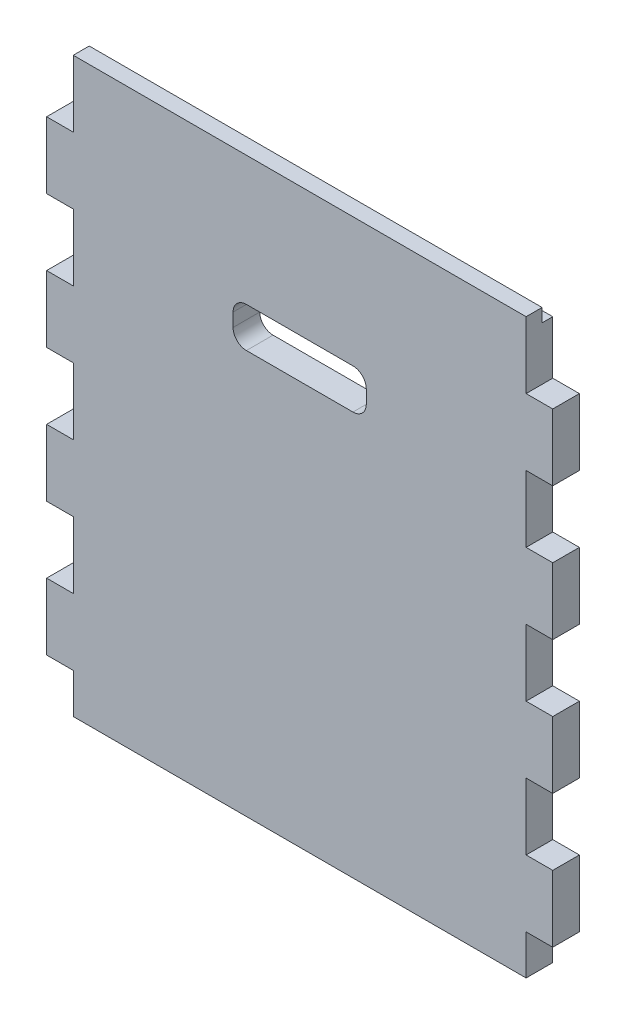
SolidWorks part; units mm, degrees
ref_plane "Front" through (0, 0, 0) normal (0, 0, 1) x (1, 0, 0)
ref_plane "Top" through (0, 0, 0) normal (0, 1, 0) x (1, 0, 0)
ref_plane "Right" through (0, 0, 0) normal (1, 0, 0) x (0, 0, -1)
sketch "Sketch1" plane through (0, 0, 0) normal (0, 0, 1) x (1, 0, 0)
  line L0 (0, 50) -> (20, 50)
  line L2 (0, 50) -> (0, 100)
  line L3 (20, 450) -> (360, 450)
  line L4 (380, 50) -> (380, 100)
  line L5 (0, 100) -> (20, 100)
  line L6 (0, 150) -> (20, 150)
  line L7 (0, 200) -> (20, 200)
  line L8 (0, 250) -> (20, 250)
  line L9 (0, 300) -> (20, 300)
  line L10 (0, 350) -> (20, 350)
  line L11 (0, 400) -> (20, 400)
  line L12 (360, 450) -> (360, 400)
  line L13 (20, 20) -> (20, 50)
  line L14 (20, 100) -> (20, 150)
  line L15 (0, 150) -> (0, 200)
  line L16 (20, 200) -> (20, 250)
  line L17 (0, 250) -> (0, 300)
  line L18 (20, 300) -> (20, 350)
  line L19 (0, 350) -> (0, 400)
  line L20 (20, 400) -> (20, 450)
  line L21 (360, 350) -> (380, 350)
  line L22 (360, 400) -> (380, 400)
  line L23 (360, 300) -> (380, 300)
  line L24 (360, 250) -> (380, 250)
  line L25 (360, 200) -> (380, 200)
  line L26 (360, 150) -> (380, 150)
  line L27 (360, 100) -> (380, 100)
  line L28 (360, 50) -> (380, 50)
  line L29 (360, 50) -> (360, 20)
  line L30 (380, 150) -> (380, 200)
  line L31 (360, 150) -> (360, 100)
  line L32 (380, 250) -> (380, 300)
  line L33 (360, 250) -> (360, 200)
  line L34 (380, 350) -> (380, 400)
  line L35 (360, 350) -> (360, 300)
  line L36 (360, 20) -> (20, 20)
  line L38 (20, 0) -> (360, 0)
  dimension "D1" = 50
  dimension "D3" = 20
  dimension "D4" = 20
  dimension "D5" = 30
extrude "Extrude1" add sketch "Sketch1" along normal blind 20
sketch "Sketch2" plane through (0, 0, 20) normal (0, 0, 1) x (1, 0, 0)
  line L0 (190, 494.8097) -> (190, 44.8097) construction
  line L1 (150, 353) -> (230, 353)
  line L2 (140, 343) -> (140, 333)
  line L3 (150, 323) -> (230, 323)
  line L4 (240, 343) -> (240, 333)
  line L5 (360, 450) -> (20, 450) construction
  line L6 (380, 350) -> (380, 400) construction
  arc A0 (150, 353) -> (140, 343) centre (150, 343) ccw
  arc A1 (150, 323) -> (140, 333) centre (150, 333) cw
  arc A2 (240, 333) -> (230, 323) centre (230, 333) cw
  arc A3 (230, 353) -> (240, 343) centre (230, 343) cw
  dimension "D2" = 10
  dimension "D1" = 50
  dimension "D3" = 127
  dimension "D4" = 190
  dimension "D5" = 97
  dimension "D6" = 100
extrude "Extrude2" cut sketch "Sketch2" against normal through all
sketch "Sketch4" plane through (0, 0, 0) normal (0, 0, -1) x (-1, 0, 0)
  line L0 (-20, 450) -> (-20, 400) construction
  line L1 (-360, 450) -> (-20, 450)
  line L2 (-360, 450) -> (-360, 440)
  line L3 (-360, 440) -> (-20, 440)
  line L4 (-20, 450) -> (-20, 440)
  dimension "D1" = 10
extrude "Extrude4" cut sketch "Sketch4" against normal blind 8
